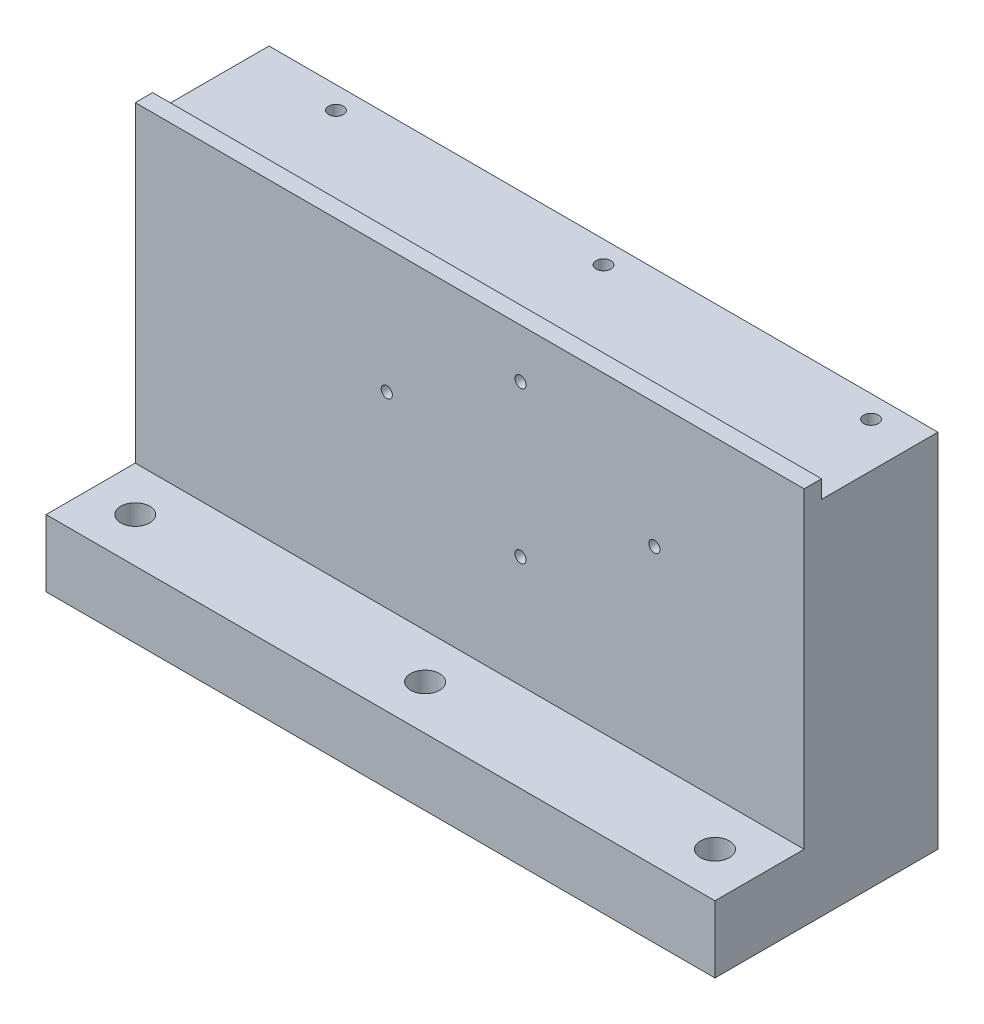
SolidWorks part; units mm, degrees
ref_plane "前视基准面" through (0, 0, 0) normal (0, 0, 1) x (1, 0, 0)
ref_plane "上视基准面" through (0, 0, 0) normal (0, 1, 0) x (1, 0, 0)
ref_plane "右视基准面" through (0, 0, 0) normal (1, 0, 0) x (0, 0, -1)
sketch "草图1" plane through (0, 0, 0) normal (0, 0, 1) x (1, 0, 0)
  line L0 (0, 0) -> (0, 85)
  line L1 (150, 0) -> (150, 85)
  line L2 (0, 0) -> (150, 0)
  line L3 (0, 85) -> (150, 85)
extrude "凸台-拉伸1" add sketch "草图1" along normal blind 50
sketch "草图2" plane through (150, 0, 0) normal (1, 0, 0) x (0, 0, -1)
  line L0 (-26.1, 81) -> (-26.1, 85)
  line L1 (0, 0) -> (0, 81)
  line L2 (-30, 15) -> (-30, 85)
  line L3 (-26.1, 81) -> (0, 81)
  line L4 (-30, 85) -> (-26.1, 85)
  line L5 (-50, 15) -> (-30, 15)
  line L6 (-50, 0) -> (0, 0)
  line L7 (-50, 0) -> (-50, 15)
extrude "切除-拉伸1" cut sketch "草图2" against normal through all flip side to cut
sketch "草图3" plane through (0, 0, 30) normal (0, 0, 1) x (1, 0, 0)
  circle A0 centre (56.4, 57) radius 1.25
  circle A1 centre (116.4, 57) radius 1.25
  circle A2 centre (86.4, 74) radius 1.25
  circle A3 centre (86.4, 40) radius 1.25
extrude "切除-拉伸2" cut sketch "草图3" against normal blind 10
sketch "草图4" plane through (0, 0, 30) normal (0, 0, 1) x (1, 0, 0)
  circle A0 centre (116.25, 70) radius 1.65 construction
  circle A1 centre (146.25, 70) radius 1.65 construction
sketch "草图5" plane through (0, 0, 0) normal (0, 0, -1) x (-1, 0, 0)
  circle A0 centre (-146.25, 70) radius 1.65
  circle A1 centre (-116.25, 70) radius 1.65
extrude "切除-拉伸3" cut sketch "草图5" against normal blind 10
sketch "草图6" plane through (150, 0, 0) normal (1, 0, 0) x (0, 0, -1)
  circle A0 centre (-24, 62) radius 2.1 construction
  circle A1 centre (-6, 62) radius 2.1 construction
sketch "草图7" plane through (0, 0, 0) normal (-1, 0, 0) x (0, 0, 1)
  circle A0 centre (6, 62) radius 2.1
  circle A1 centre (24, 62) radius 2.1
extrude "切除-拉伸4" cut sketch "草图7" against normal blind 10
sketch "草图8" plane through (0, 81, 0) normal (0, 1, 0) x (1, 0, 0)
  circle A0 centre (20, -5) radius 1.65
  circle A1 centre (140, -5) radius 1.65
  circle A2 centre (80, -5) radius 1.65
extrude "切除-拉伸5" cut sketch "草图8" against normal blind 10
sketch "草图9" plane through (0, 15, 0) normal (0, 1, 0) x (1, 0, 0)
  circle A0 centre (10, -40) radius 3.25
  circle A1 centre (75, -40) radius 3.25
  circle A2 centre (140, -40) radius 3.25
extrude "切除-拉伸6" cut sketch "草图9" against normal through all
